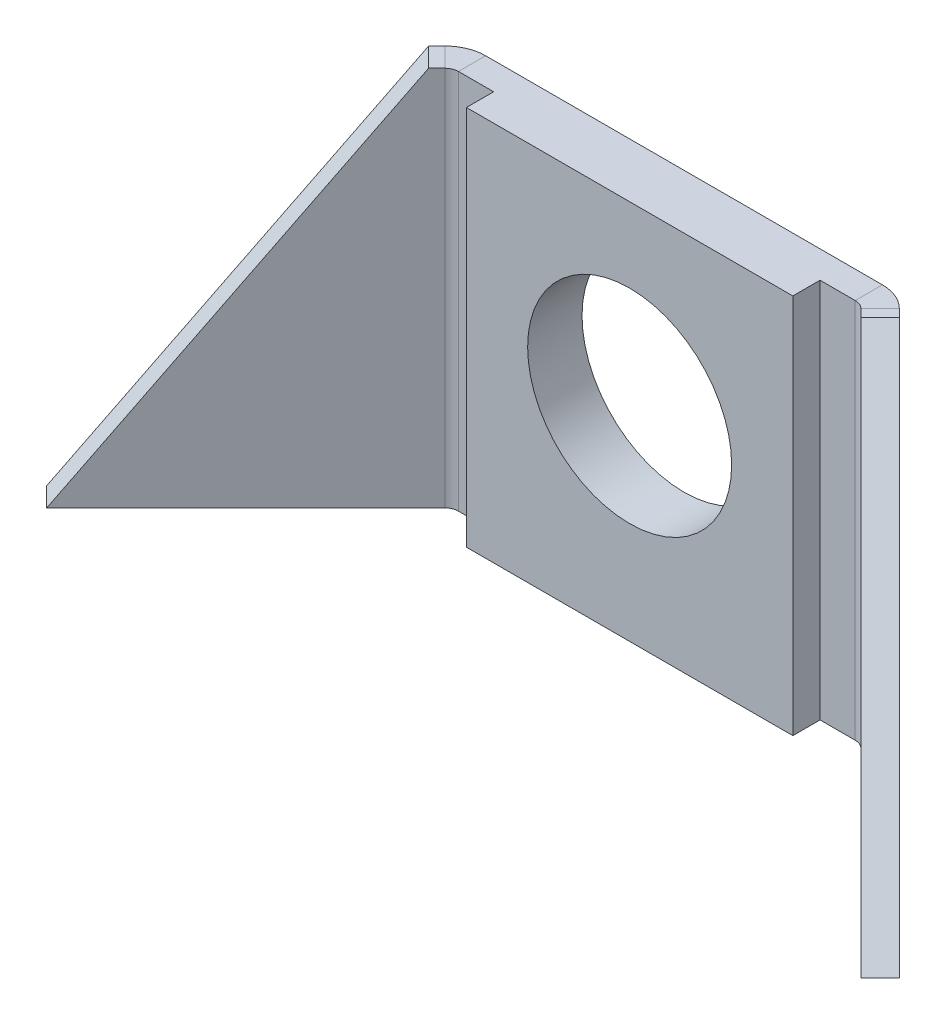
SolidWorks part; units mm, degrees
ref_plane "Front Plane" through (0, 0, 0) normal (0, 0, 1) x (1, 0, 0)
ref_plane "Top Plane" through (0, 0, 0) normal (0, 1, 0) x (1, 0, 0)
ref_plane "Right Plane" through (0, 0, 0) normal (1, 0, 0) x (0, 0, -1)
sketch "Sketch1" plane through (0, 0, 0) normal (0, 0, 1) x (1, 0, 0)
  line L0 (-53.975, 0) -> (53.975, 0)
  line L1 (53.975, 0) -> (117.0239, 0)
  line L2 (117.0239, 0) -> (53.975, 88.9)
  line L3 (53.975, 88.9) -> (-53.975, 88.9)
  line L4 (0, 0) -> (0, 88.9) construction
  line L5 (-117.0239, 0) -> (-53.975, 88.9)
  line L6 (-53.975, 0) -> (-117.0239, 0)
  line L7 (-47.625, 88.9) -> (-47.625, 0) construction
  line L8 (47.625, 88.9) -> (47.625, 0) construction
  dimension "D1" = 107.95
  dimension "D2" = 6.35
  dimension "D3" = 6.35
  dimension "D4" = 88.9
base flange "Base-Flange1" sketch "Sketch1" thickness 6.35 reverse thickness direction no parameters "D1"=3.175
sketch "Sketch6" plane through (0, 0, 0) normal (0, 0, 1) x (1, 0, 0)
  line L0 (-47.625, 88.9) -> (-47.625, 0)
  line L1 (53.975, 88.9) -> (-53.975, 88.9) construction
  line L2 (-117.0239, 0) -> (117.0239, 0) construction
  line L3 (47.625, 88.9) -> (47.625, 0)
  dimension "D1" = 6.35
  dimension "D2" = 6.35
sketched bend "Sketched Bend1" thickness 6.35 parameters "D1"=0
bend "SketchBend1" bend radius 3.175 bend angle 45 parameters "D5"=1
bend "SketchBend2" bend radius 0 bend angle 45 parameters "D5"=2
sketch "Sketch7" plane through (0, 0, 0) normal (0, 0, 1) x (1, 0, 0)
  line L0 (46.3099, 88.9) -> (-46.3099, 88.9) construction
  line L1 (-38.1, 88.9) -> (38.1, 88.9)
  line L2 (-38.1, 88.9) -> (-38.1, 0)
  line L3 (-38.1, 0) -> (38.1, 0)
  line L4 (38.1, 88.9) -> (38.1, 0)
  line L5 (-38.1, 88.9) -> (38.1, 0) construction
  line L6 (-38.1, 0) -> (38.1, 88.9) construction
  line L7 (-46.3099, 0) -> (46.3099, 0) construction
  point P4 (0, 44.45)
  dimension "D1" = 76.2
extrude "Boss-Extrude1" add sketch "Sketch7" along normal blind 6.35
sketch "Sketch9" plane through (0, 0, 6.35) normal (0, 0, 1) x (1, 0, 0)
  circle A0 centre (0, 47.625) radius 23.8125
  dimension "D1" = 47.625
extrude "Cut-Extrude1" cut sketch "Sketch9" against normal through all contours A0
sketch "Bend-Lines1" [suppressed] plane through (0, 0, 0) normal (0, 1, 0) x (1, 0, 0)
sketch "Bounding-Box1" [suppressed] plane through (0, 0, 0) normal (0, 1, 0) x (1, 0, 0)
sheet metal parameters "Sheet-Metal1" thickness 6.35 parameters "D1"=3.175
flat pattern "Flat-Pattern1"
sketch "Bend-Lines2" plane through (0, 0, 0) normal (0, 0, 1) x (1, 0, 0)
  line L0 (48.4367, 0) -> (48.4367, 47.8824) construction
  line L1 (-48.4367, 47.8824) -> (-48.4367, 0) construction
  line L2 (48.4367, 0) -> (48.4367, 47.8824) construction
  line L3 (-48.4367, 47.8824) -> (-48.4367, 0) construction
sketch3d "Bounding-Box2" [suppressed]
  line L0 (-101.8574, 0, 0) -> (95.5074, 0, 0) construction
  line L1 (-101.8574, 47.8824, 0) -> (95.5074, 47.8824, 0) construction
  line L2 (-101.8574, 0, 0) -> (-101.8574, 47.8824, 0) construction
  line L3 (95.5074, 0, 0) -> (95.5074, 47.8824, 0) construction
bend of the flat pattern "Flatten-<SketchBend1>1"
bend of the flat pattern "Flatten-<SketchBend2>1"
sheet metal parameters "Sheet-Metal2" thickness 6.35 parameters "D1"=3.175
flat pattern "Flat-Pattern1"
sketch "Bend-Lines2" plane through (0, 0, 0) normal (0, 0, 1) x (1, 0, 0)
  line L0 (48.4367, 0) -> (48.4367, 88.9) construction
  line L1 (-48.4367, 88.9) -> (-48.4367, 0) construction
  line L2 (48.4367, 0) -> (48.4367, 88.9) construction
  line L3 (-48.4367, 88.9) -> (-48.4367, 0) construction
sketch3d "Bounding-Box2" [suppressed]
  line L0 (-117.0239, 0, 6.35) -> (117.0239, 0, 6.35) construction
  line L1 (-117.0239, 88.9, 6.35) -> (117.0239, 88.9, 6.35) construction
  line L2 (-117.0239, 0, 6.35) -> (-117.0239, 88.9, 6.35) construction
  line L3 (117.0239, 0, 6.35) -> (117.0239, 88.9, 6.35) construction
bend of the flat pattern "Flatten-<SketchBend1>1"
bend of the flat pattern "Flatten-<SketchBend2>1"
sheet metal parameters "Sheet-Metal3" thickness 6.35 parameters "D1"=3.175
flat pattern "Flat-Pattern1"
sketch "Bend-Lines2" plane through (0, 0, 0) normal (0, 0, 1) x (1, 0, 0)
  line L0 (48.8035, 0) -> (48.8035, 88.9) construction
  line L1 (-48.8035, 88.9) -> (-48.8035, 0) construction
  line L2 (48.8035, 0) -> (48.8035, 88.9) construction
  line L3 (-48.8035, 88.9) -> (-48.8035, 0) construction
sketch3d "Bounding-Box2" [suppressed]
  line L0 (-117.0239, 0, 6.35) -> (117.0239, 0, 6.35) construction
  line L1 (-117.0239, 88.9, 6.35) -> (117.0239, 88.9, 6.35) construction
  line L2 (-117.0239, 0, 6.35) -> (-117.0239, 88.9, 6.35) construction
  line L3 (117.0239, 0, 6.35) -> (117.0239, 88.9, 6.35) construction
bend of the flat pattern "Flatten-<SketchBend1>1"
bend of the flat pattern "Flatten-<SketchBend2>1"
